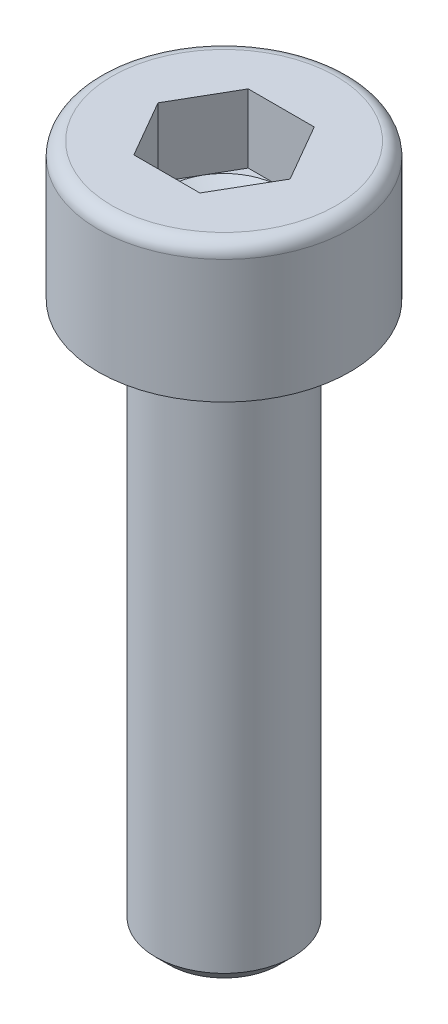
SolidWorks part; units mm, degrees
ref_plane "Plan1" through (0, 0, 0) normal (0, 0, 1) x (1, 0, 0)
ref_plane "Plan2" through (0, 0, 0) normal (0, 1, 0) x (1, 0, 0)
ref_plane "Plan3" through (0, 0, 0) normal (1, 0, 0) x (0, 0, -1)
sketch "Esquisse2" plane through (0, 0, 0) normal (0, 1, 0) x (1, 0, 0)
  circle A0 centre (0, 0) radius 1.5
  dimension "Diamètre nominal" = 3
extrude "Base-Extrusion" add sketch "Esquisse2" against normal blind 12
chamfer "Chanfrein1" distance 0.3 angle 45
sketch "Esquisse5" plane through (0, 0, 0) normal (0, 0, 1) x (1, 0, 0)
  line L0 (-2.75, 0) -> (2.75, 0) construction
  line L1 (1.25, 3) -> (1.25, 1.5)
  line L2 (0, 0) -> (2.75, 0)
  line L3 (0, 0) -> (0, 0.7783)
  line L4 (1.25, 3) -> (2.45, 3)
  line L5 (2.75, 0) -> (2.75, 2.7)
  line L6 (1.25, 1.5) -> (0, 0.7783)
  line L7 (0, 3) -> (0, -12) construction
  line L8 (0, -11.7) -> (0, 0) construction
  line L9 (-1.2, -12) -> (1.2, -12) construction
  line L10 (1.25, 0) -> (-1.25, 0) construction
  arc A0 (2.75, 2.7) -> (2.45, 3) centre (2.45, 2.7) ccw
  dimension "D2" = 0.3
  dimension "D1" = 2.75
  dimension "Cote sur plats" = 2.5
  dimension "D3" = 60
  dimension "D4" = 1.5
  dimension "Diamètre tête" = 5.5
  dimension "Diamètre nominal" = 3
  dimension "D5" = 1.25
revolve "Boss.-Révol.1" add sketch "Esquisse5" angle 360 about L7
sketch "Esquisse7" plane through (0, 3, 0) normal (0, 1, 0) x (-1, 0, 0)
  line L0 (0, -1.25) -> (0, 1.25) construction
  line L1 (0, 0) -> (-0.7217, 1.25) construction
  line L2 (0, 0) -> (-1.0825, 0.625) construction
  line L3 (0, 0) -> (-1.4434, 0) construction
  line L4 (0.7217, 1.25) -> (-0.7217, 1.25)
  line L5 (-0.7217, 1.25) -> (-1.4434, 0)
  line L6 (0.7217, -1.25) -> (-0.7217, -1.25)
  line L7 (-0.7217, -1.25) -> (-1.4434, 0)
  line L8 (0.7217, 1.25) -> (1.4434, 0)
  line L9 (0.7217, -1.25) -> (1.4434, 0)
  circle A2 centre (0, 0) radius 1.25 construction
  dimension "D1" = 30
  dimension "D2" = 30
extrude "Enlèv. mat.-Extru.1" cut sketch "Esquisse7" against normal blind 1.5
equation "\"D1@Chanfrein1\" = \"Diamètre nominal@Esquisse2\"*0.1"
equation "\"D1@Esquisse5\" = \"Diamètre tête@Esquisse5\"/2"
equation "\"D2@Esquisse5\" = \"Diamètre nominal@Esquisse5\"*0.1"
equation "\"D4@Esquisse5\" = \"Diamètre nominal@Esquisse5\"/2"
equation "\"D5@Esquisse5\" = \"Cote sur plats@Esquisse5\"/2"
equation "\"D1@Enlèv. mat.-Extru.1\" = \"Diamètre nominal@Esquisse5\"/2"
